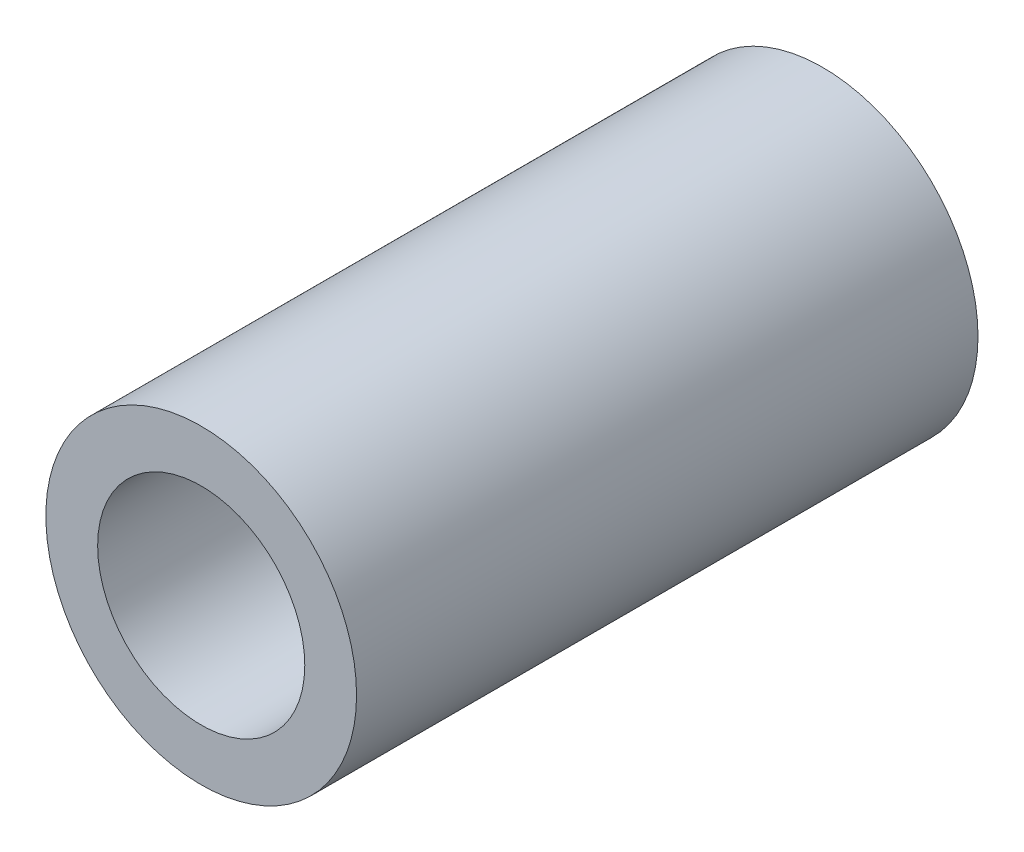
SolidWorks part; units mm, degrees
ref_plane "Front" through (0, 0, 0) normal (0, 0, 1) x (1, 0, 0)
ref_plane "Top" through (0, 0, 0) normal (0, 1, 0) x (1, 0, 0)
ref_plane "Right" through (0, 0, 0) normal (1, 0, 0) x (0, 0, -1)
sketch "Sketch1" plane through (0, 0, 0) normal (0, 0, 1) x (1, 0, 0)
  circle A0 centre (0, 0) radius 3
  circle A1 centre (0, 0) radius 2
  dimension "D1" = 6
  dimension "D2" = 4
extrude "Extrude1" add sketch "Sketch1" along normal blind 12
